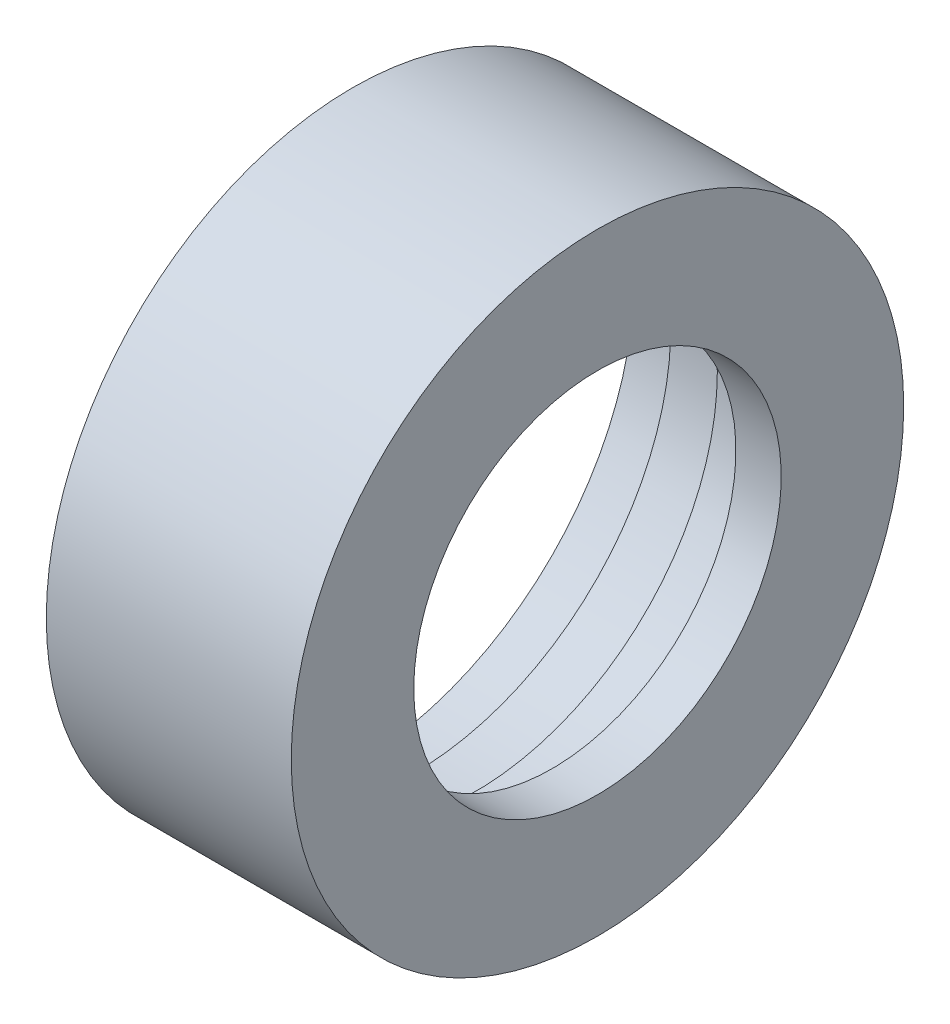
SolidWorks part; units mm, degrees
ref_plane "Front Plane" through (0, 0, 0) normal (0, 0, 1) x (1, 0, 0)
ref_plane "Top Plane" through (0, 0, 0) normal (0, 1, 0) x (1, 0, 0)
ref_plane "Right Plane" through (0, 0, 0) normal (1, 0, 0) x (0, 0, -1)
sketch "Sketch1" plane through (0, 0, 0) normal (0, 0, 1) x (1, 0, 0)
  line L0 (-300.7377, 0) -> (-246.0276, 0) construction
  line L3 (-269.3127, 25.125) -> (-276.2966, 25.125)
  line L4 (-269.2918, 25) -> (-268.2958, 19.05)
  line L5 (-269.2918, 25) -> (-269.3127, 25.125)
  line L8 (-268.2958, 19.05) -> (-263.5966, 19.05)
  line L9 (-263.5966, 19.05) -> (-263.5966, 31.75)
  line L10 (-263.5966, 31.75) -> (-288.9966, 31.75)
  line L11 (-288.9966, 31.75) -> (-288.9966, 29.2)
  line L12 (-288.9966, 29.2) -> (-282.6966, 29.2)
  line L13 (-282.6966, 29.2) -> (-282.6966, 26.7)
  line L14 (-282.6966, 26.7) -> (-276.2966, 26.7)
  line L15 (-276.2966, 26.7) -> (-276.2966, 25.125)
  arc A0 (-269.2918, -25) -> (-269.2918, 25) centre (-418.6453, 0) ccw construction
  arc A1 (-269.2918, -25) -> (-267.2139, 0) centre (-418.6453, 0) ccw construction
  dimension "D1" = 63.5
  dimension "D2" = 58.4
  dimension "D3" = 53.4
  dimension "D4" = 38.1
  dimension "D5" = 25.4
  dimension "D6" = 19.1
  dimension "D7" = 12.7
  dimension "D8" = 99.503
revolve "Revolve1" add sketch "Sketch1" angle 360 about L0
